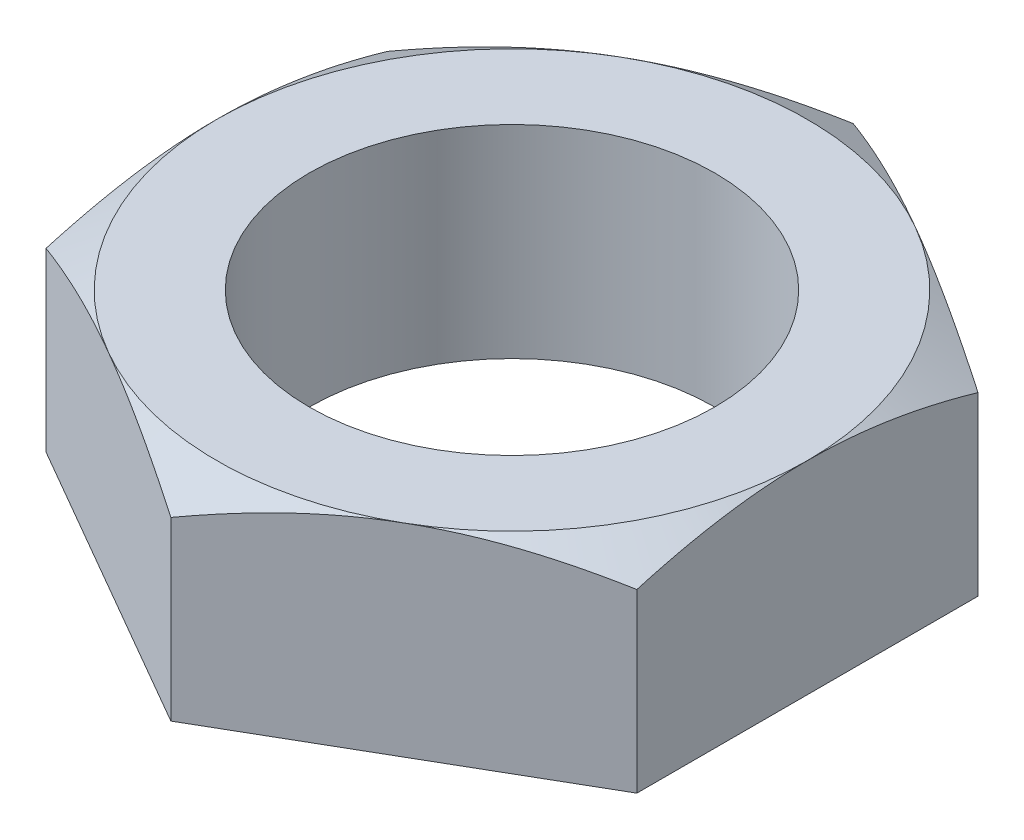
SolidWorks part; units mm, degrees
ref_plane "Front" through (0, 0, 0) normal (0, 0, 1) x (1, 0, 0)
ref_plane "Top" through (0, 0, 0) normal (0, 1, 0) x (1, 0, 0)
ref_plane "Right" through (0, 0, 0) normal (1, 0, 0) x (0, 0, -1)
sketch "Sketch1" plane through (0, 0, 0) normal (0, 1, 0) x (1, 0, 0)
  line L1 (0, 15.1419) -> (-13.1132, 7.5709)
  line L2 (-13.1132, 7.5709) -> (-13.1132, -7.5709)
  line L3 (-13.1132, -7.5709) -> (0, -15.1419)
  line L4 (0, -15.1419) -> (13.1132, -7.5709)
  line L5 (13.1132, -7.5709) -> (13.1132, 7.5709)
  line L6 (13.1132, 7.5709) -> (0, 15.1419)
  circle A0 centre (0, 0) radius 13.1132 construction
  circle A1 centre (0, 0) radius 9
  dimension "D1" = 18
extrude "Boss-Extrude1" add sketch "Sketch1" along normal blind 9
sketch "Sketch2" plane through (0, 9, 0) normal (0, 1, 0) x (1, 0, 0)
  circle A0 centre (0, 0) radius 13.1132
extrude "Cut-Extrude1" cut sketch "Sketch2" against normal blind 5 draft 60 flip side to cut
